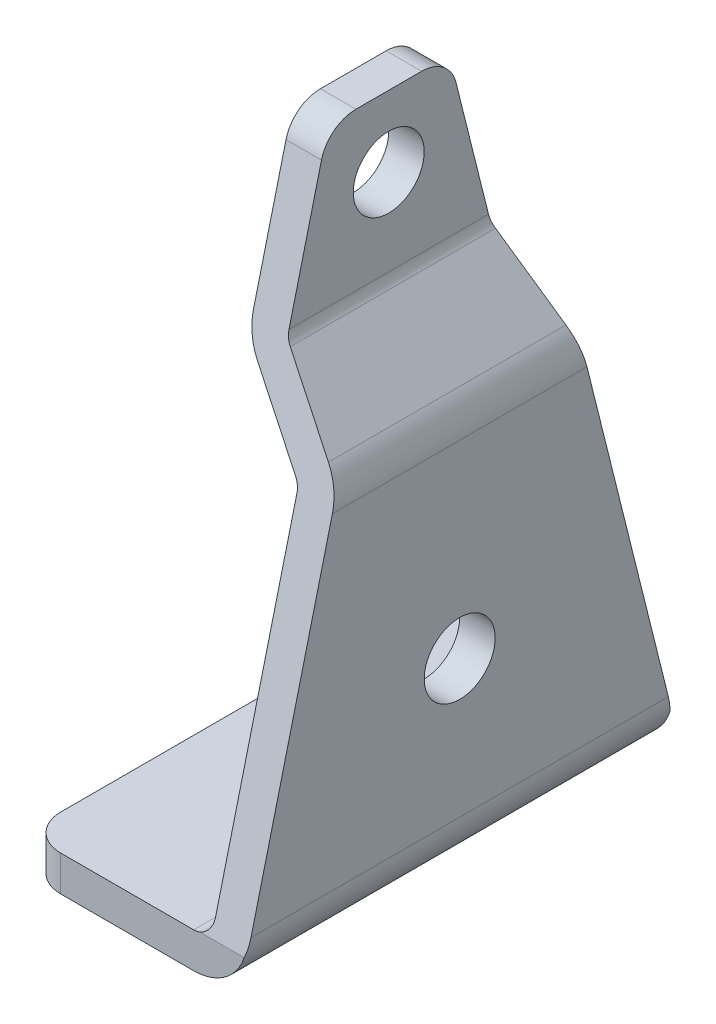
SolidWorks part; units mm, degrees
ref_plane "Plan1" through (0, 0, 0) normal (0, 0, 1) x (1, 0, 0)
ref_plane "Plan2" through (0, 0, 0) normal (0, 1, 0) x (1, 0, 0)
ref_plane "Plan3" through (0, 0, 0) normal (1, 0, 0) x (0, 0, -1)
sketch "Esquisse1" plane through (0, 0, 0) normal (0, 0, 1) x (1, 0, 0)
  line L0 (0, 0) -> (19, 0)
  line L1 (25, 6) -> (25, 42.8162)
  line L2 (23.5963, 46.6729) -> (17.4679, 53.9764)
  line L3 (17, 55.262) -> (17, 73)
  line L4 (17, 73) -> (13, 73)
  line L5 (13, 73) -> (13, 55.262)
  line L6 (14.4037, 51.4052) -> (20.5321, 44.1018)
  line L7 (21, 42.8162) -> (21, 6)
  line L8 (19, 4) -> (0, 4)
  line L9 (0, 4) -> (0, 0)
  line L10 (25, 45) -> (21.9358, 42.4288) construction
  arc A0 (21, 42.8162) -> (20.5321, 44.1018) centre (19, 42.8162) ccw
  arc A1 (19, 4) -> (21, 6) centre (19, 6) ccw
  arc A2 (17, 55.262) -> (17.4679, 53.9764) centre (19, 55.262) ccw
  arc A3 (25, 6) -> (19, 0) centre (19, 6) cw
  arc A4 (23.5963, 46.6729) -> (25, 42.8162) centre (19, 42.8162) cw
  arc A5 (14.4037, 51.4052) -> (13, 55.262) centre (19, 55.262) cw
  point P16 (21, 4)
  point P21 (25, 0)
  dimension "D10" = 2
  dimension "D11" = 6
  dimension "D1" = 25
  dimension "D2" = 4
  dimension "D3" = 4
  dimension "D4" = 73
  dimension "D5" = 4
  dimension "D6" = 45
  dimension "D7" = 40
  dimension "D8" = 8
  dimension "D9" = 4
extrude "Base-Extrusion" add sketch "Esquisse1" along normal blind 48
sketch "Esquisse2" plane through (25, 0, 0) normal (1, 0, 0) x (0, 0, -1)
  line L0 (-48, 4.1336) -> (-30.8297, 73)
  line L3 (-48, 73) -> (0, 73) construction
  line L4 (-30.8297, 73) -> (-48, 73)
  line L5 (-48, 6) -> (-48, 0) construction
  line L6 (-48, 4.1336) -> (-48, 73)
  line L7 (0, 4.1336) -> (-17.1703, 73)
  line L8 (0, 0) -> (0, 6) construction
  line L9 (-17.1703, 73) -> (0, 73)
  line L10 (0, 73) -> (0, 4.1336)
  dimension "D1" = 14
  dimension "D2" = 14
extrude "Enlèv. mat.-Extru.1" cut sketch "Esquisse2" against normal through all
fillet "Congé5" radius 4
sketch "Esquisse3" plane through (13, 0, 0) normal (-1, 0, 0) x (0, 0, 1)
  circle A0 centre (24, 65) radius 4
  dimension "D3" = 8
  dimension "D1" = 24
  dimension "D2" = 8
extrude "Enlèv. mat.-Extru.2" cut sketch "Esquisse3" against normal through all
sketch "Esquisse4" plane through (25, 0, 0) normal (1, 0, 0) x (0, 0, -1)
  line L0 (-9.6447, 42.8162) -> (-0.4653, 6) construction
  line L1 (-48, 0) -> (0, 0) construction
  circle A0 centre (-24, 21.5) radius 4
  dimension "D1" = 21.5
extrude "Enlèv. mat.-Extru.4" cut sketch "Esquisse4" against normal through all
